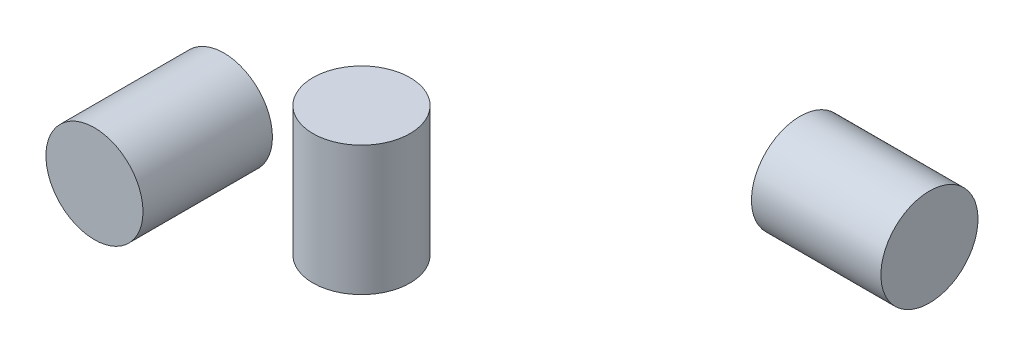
SolidWorks part; units mm, degrees
ref_plane "前视基准面" through (0, 0, 0) normal (0, 0, 1) x (1, 0, 0)
ref_plane "上视基准面" through (0, 0, 0) normal (0, 1, 0) x (1, 0, 0)
ref_plane "右视基准面" through (0, 0, 0) normal (1, 0, 0) x (0, 0, -1)
sketch "草图1" plane through (0, 0, 0) normal (0, 0, 1) x (1, 0, 0)
  circle A0 centre (0, 0) radius 15
  dimension "D1" = 30
sketch "草图3" plane through (0, 0, 0) normal (0, 1, 0) x (1, 0, 0)
  circle A0 centre (60.3428, -17.82) radius 15
  dimension "D1" = 30
sketch "草图4" plane through (0, 0, 0) normal (1, 0, 0) x (0, 0, -1)
  circle A0 centre (178.0322, -105.9513) radius 15
  dimension "D1" = 30
extrude "凸台-拉伸1" add sketch "草图1" along normal blind 40
extrude "凸台-拉伸2" add sketch "草图3" along normal blind 40 separate body
extrude "凸台-拉伸3" add sketch "草图4" along normal blind 40 separate body
